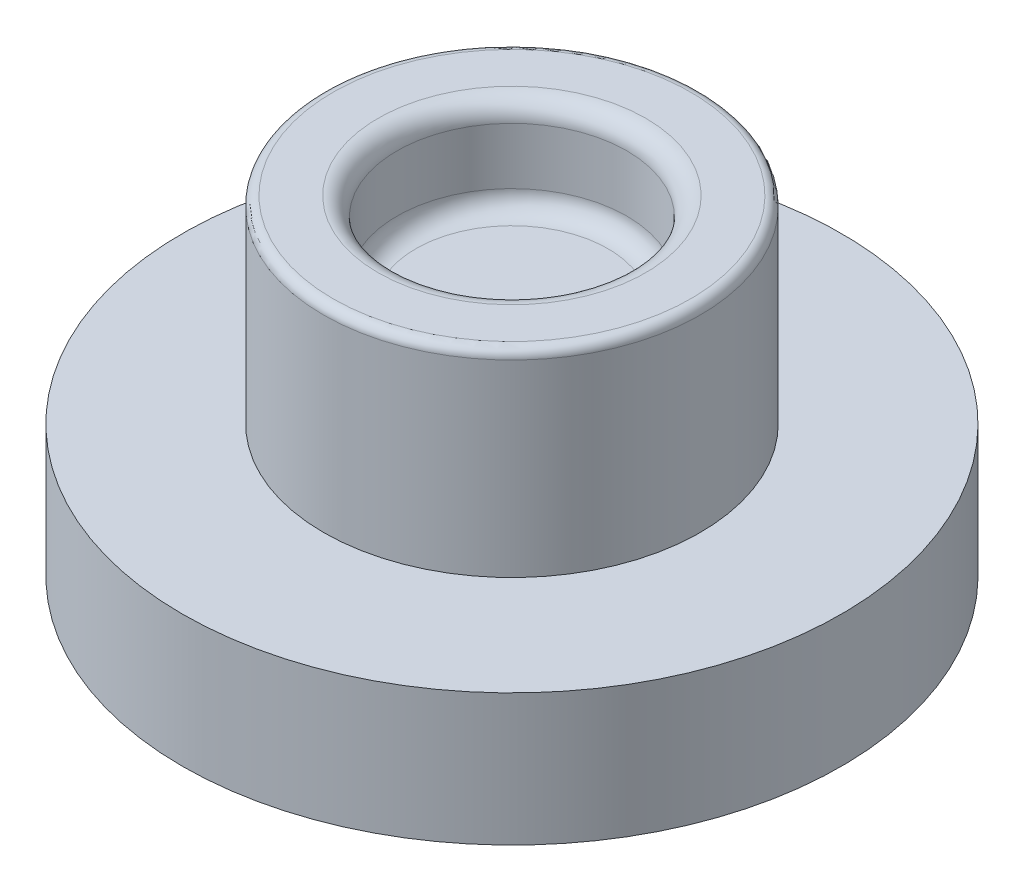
SolidWorks part; units mm, degrees
ref_plane "Front Plane" through (0, 0, 0) normal (0, 0, 1) x (1, 0, 0)
ref_plane "Top Plane" through (0, 0, 0) normal (0, 1, 0) x (1, 0, 0)
ref_plane "Right Plane" through (0, 0, 0) normal (1, 0, 0) x (0, 0, -1)
ref_plane "Plane1" through (0, 0, 0) normal (0, 0, -1) x (-1, 0, 0)
sketch "Sketch1" plane through (0, 0, 0) normal (0, 0, -1) x (-1, 0, 0)
  line L0 (-3.5, -1.4) -> (0, -1.4)
  line L1 (0, -1.4) -> (0, 1.1)
  line L2 (0, 1.1) -> (-1.0212, 1.1)
  line L3 (-1.2212, 1.3) -> (-1.2212, 1.9)
  line L4 (-1.4212, 2.1) -> (-1.9, 2.1)
  line L5 (-2, 2) -> (-2, 0)
  line L6 (-2, 0) -> (-3.5, 0)
  line L7 (-3.5, 0) -> (-3.5, -1.4)
  line L8 (0, -1.4) -> (0, 2.1021) construction
  arc A0 (-1.0212, 1.1) -> (-1.2212, 1.3) centre (-1.0212, 1.3) cw
  arc A1 (-1.2212, 1.9) -> (-1.4212, 2.1) centre (-1.4212, 1.9) ccw
  arc A2 (-1.9, 2.1) -> (-2, 2) centre (-1.9, 2) ccw
revolve "Revolve1" add sketch "Sketch1" angle 360 about L8
